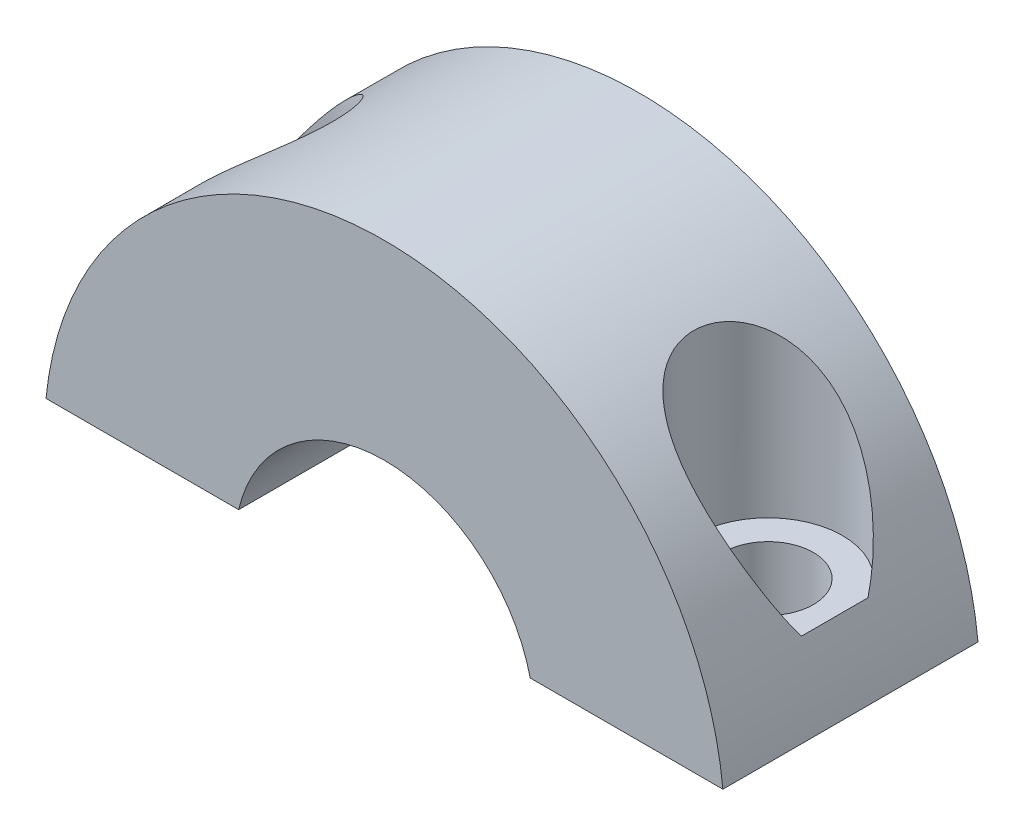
SolidWorks part; units mm, degrees
ref_plane "Front Plane" through (0, 0, 0) normal (0, 0, 1) x (1, 0, 0)
ref_plane "Top Plane" through (0, 0, 0) normal (0, 1, 0) x (1, 0, 0)
ref_plane "Right Plane" through (0, 0, 0) normal (1, 0, 0) x (0, 0, -1)
sketch "Sketch1" plane through (0, 0, 0) normal (0, 0, 1) x (1, 0, 0)
  line L0 (-25.2727, 2.54) -> (-10.8835, 2.54)
  line L1 (10.8835, 2.54) -> (25.2727, 2.54)
  line L2 (-29.1642, 2.54) -> (29.724, 2.54) construction
  arc A0 (-25.2727, 2.54) -> (25.2727, 2.54) centre (0, 0) cw
  arc A1 (10.8835, 2.54) -> (-10.8835, 2.54) centre (0, 0) ccw
  dimension "D1" = 11.176
  dimension "D2" = 25.4
  dimension "D3" = 2.54
extrude "Boss-Extrude1" add sketch "Sketch1" along normal blind 19.05 contours A0 L1 A1 L0
ref_plane "Plane1" through (0, 28.575, 0) normal (0, 1, 0) x (1, 0, 0)
hole_wizard "CBORE for 1/4 Socket Head Cap Screw2" positions "Sketch7" profile "Sketch8" counterbore size "1/4" standard "ANSI Inch"
sketch "Sketch7" plane through (0, 28.575, 0) normal (0, 1, 0) x (1, 0, 0)
  line L0 (10.8835, 0) -> (-10.8835, 0) construction
  line L1 (25.2727, 0) -> (-25.2727, 0) construction
  line L2 (-25.2727, -19.05) -> (25.2727, -19.05) construction
  point P0 (19.05, -9.4488)
  point P2 (-19.05, -9.4488)
  point P6 (0, 0)
  point P10 (0, 0)
  dimension "D1" = 19.05
  dimension "D2" = 19.05
  dimension "D3" = 9.6012
sketch "Sketch8" plane through (19.05, 28.575, 9.4488) normal (1, 0, 0) x (0, 0, 1)
  line L0 (0, 0) -> (0, 26.035)
  line L1 (0, 26.035) -> (3.3782, 26.035)
  line L3 (3.3782, 26.035) -> (3.3782, 20.32)
  line L4 (3.3782, 20.32) -> (5.5562, 20.32)
  line L5 (5.5562, 20.32) -> (5.5562, 0)
  line L7 (5.5562, 0) -> (0, 0)
  line L11 (0, -6.35) -> (0, 107.95) construction
  dimension "Thru Hole Dia." = 6.7564
  dimension "Thru Hole Depth" = 26.035
  dimension "C'Bore Dia." = 11.1125
  dimension "C'Bore Depth" = 20.32
